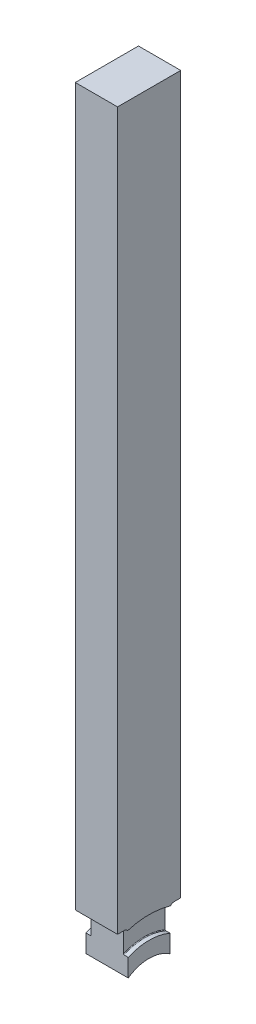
SolidWorks part; units mm, degrees
ref_plane "Front Plane" through (0, 0, 0) normal (0, 0, 1) x (1, 0, 0)
ref_plane "Top Plane" through (0, 0, 0) normal (0, 1, 0) x (1, 0, 0)
ref_plane "Right Plane" through (0, 0, 0) normal (1, 0, 0) x (0, 0, -1)
sketch "Sketch1" plane through (0, 0, 0) normal (1, 0, 0) x (0, 0, -1)
  line L0 (-19.177, 479.425) -> (-19.177, 0)
  line L1 (0, 249.2329) -> (0, 0) construction
  line L2 (19.177, 479.425) -> (19.177, 0)
  line L3 (-19.177, 479.425) -> (19.177, 479.425)
  line L6 (-19.177, 0) -> (19.177, 0)
  arc A0 (-22.225, 0) -> (22.225, 0) centre (0, 0) cw construction
  dimension "R" = 22.225
  dimension "L" = 457.2
  dimension "T" = 38.354
extrude "Boss-Extrude1" add sketch "Sketch1" along normal mid plane 25.654
sketch "Sketch8" plane through (0, 0, 0) normal (1, 0, 0) x (0, 0, -1)
  circle A0 centre (0, 0) radius 22.225
  arc A1 (22.225, 0) -> (-22.225, 0) centre (0, 0) ccw construction
extrude "Cut-Extrude4" cut sketch "Sketch8" against normal through all both and the other way through all
sketch "Sketch2" plane through (0, 0, 0) normal (0, 0, 1) x (1, 0, 0)
  line L0 (12.827, 31.75) -> (9.8552, 31.75)
  line L1 (12.827, 479.425) -> (12.827, 11.2336) construction
  line L2 (9.8552, 31.75) -> (9.8552, 45.2374)
  line L3 (9.8552, 45.2374) -> (12.827, 45.2374)
  line L4 (12.827, 45.2374) -> (12.827, 31.75)
  line L5 (0, 29.9173) -> (0, 0) construction
  line L6 (-12.827, 45.2374) -> (-12.827, 31.75)
  line L7 (-9.8552, 45.2374) -> (-12.827, 45.2374)
  line L8 (-9.8552, 31.75) -> (-9.8552, 45.2374)
  line L9 (-12.827, 31.75) -> (-9.8552, 31.75)
  line L10 (-8.8482, 0) -> (24.5305, 0) construction
  dimension "D1" = 19.7104
  dimension "D2" = 45.2374
  dimension "D3" = 31.75
revolve "Cut-Revolve1" cut sketch "Sketch2" angle 360 about L10
sketch "Sketch6" plane through (0, 0, 0) normal (1, 0, 0) x (0, 0, -1)
  line L0 (0, 19.903) -> (0, 0) construction
  line L1 (12.7, 0) -> (31.75, 0)
  line L2 (12.7, 0) -> (12.7, 42.037)
  line L3 (15.0876, 44.4246) -> (31.75, 44.4246)
  line L4 (31.75, 0) -> (31.75, 44.4246)
  line L9 (-12.7, 0) -> (-31.75, 0)
  line L10 (-31.75, 0) -> (-31.75, 44.4246)
  line L11 (-15.0876, 44.4246) -> (-31.75, 44.4246)
  line L12 (-12.7, 0) -> (-12.7, 42.037)
  arc A0 (12.7, 42.037) -> (15.0876, 44.4246) centre (15.0876, 42.037) cw
  arc A1 (-12.7, 42.037) -> (-15.0876, 44.4246) centre (-15.0876, 42.037) ccw
  arc A4 (19.177, 11.2336) -> (-19.177, 11.2336) centre (0, 0) ccw construction
  dimension "D3" = 2.3876
  dimension "MT" = 25.4
  dimension "D2" = 19.05
  dimension "D4" = 19.812
extrude "Cut-Extrude2" cut sketch "Sketch6" against normal through all both and the other way through all
fillet "Fillet1" radius 0.762 2 edges at (-9.8552, 45.2374, 0) (9.8552, 45.2374, 0)
fillet "Fillet2" radius 0.381 2 edges at (-9.8552, 31.75, 0) (9.8552, 31.75, 0)
